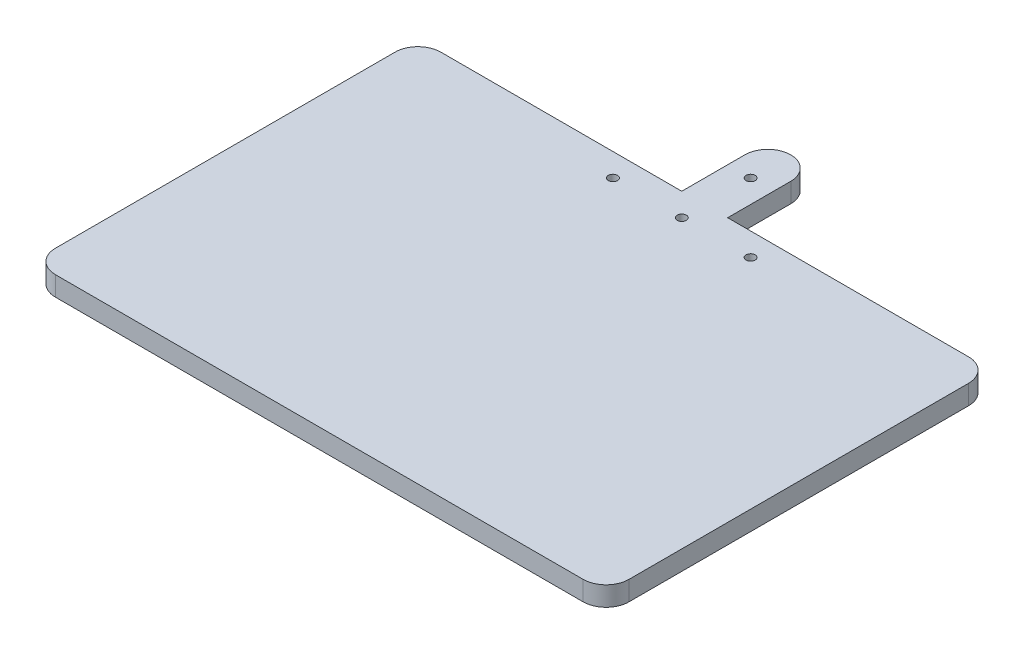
SolidWorks part; units mm, degrees
ref_plane "Front" through (0, 0, 0) normal (0, 0, 1) x (1, 0, 0)
ref_plane "Top" through (0, 0, 0) normal (0, 1, 0) x (1, 0, 0)
ref_plane "Right" through (0, 0, 0) normal (1, 0, 0) x (0, 0, -1)
sketch "Sketch1" plane through (0, 0, 0) normal (1, 0, 0) x (0, 0, -1)
  line L0 (0, 0) -> (0, -8.5)
  line L1 (0, -8.5) -> (67.49, -8.5)
  line L2 (67.49, -8.5) -> (67.49, 160.5)
  line L3 (67.49, 160.5) -> (27.987, 160.5)
  line L4 (27.987, 160.5) -> (27.987, 70)
  line L5 (27.987, 70) -> (47.49, 70)
  line L6 (47.49, 70) -> (47.49, 0)
  line L7 (47.49, 0) -> (0, 0)
  line L8 (50, 0) -> (-50, 0) construction
  line L9 (0, 50) -> (0, -50) construction
  dimension "D1" = 8.5
  dimension "D3" = 27.987
  dimension "D4" = 70
  dimension "D5" = 90.5
  dimension "D6" = 67.49
  dimension "D7" = 20
extrude "Boss-Extrude1" add sketch "Sketch1" along normal mid plane 25
hole_wizard "#55 (0.052) Diameter Hole1" positions "Sketch2" profile "Sketch3" hole size "#55" standard "ANSI Inch"
sketch "Sketch2" plane through (0, 0, -27.987) normal (0, 0, 1) x (1, 0, 0)
  line L0 (0, 77.5) -> (0, 92.5) construction
  line L1 (0, 92.5) -> (0, 107.5) construction
  line L2 (0, 107.5) -> (0, 122.5) construction
  line L4 (0, -50) -> (0, 50) construction
  line L5 (12.5, 70) -> (-12.5, 70) construction
  point P0 (0, 77.5)
  point P2 (0, 92.5)
  point P4 (0, 107.5)
  point P6 (0, 122.5)
  point P20 (0, 137.5)
  point P21 (0, 152.5)
  dimension "D1" = 15
  dimension "D2" = 7.5
  dimension "D3" = 15
  dimension "D4" = 15
sketch "Sketch3" plane through (0, 77.5, -27.987) normal (1, 0, 0) x (0, -1, 0)
  line L0 (0, 0) -> (0, 10.3968)
  line L1 (0, 10.3968) -> (0.6604, 10)
  line L2 (0.6604, 10) -> (0.6604, 0)
  line L5 (0.6604, 0) -> (0, 0)
  line L10 (0, 10.3968) -> (-0.6604, 10) construction
  line L11 (0, -6.35) -> (0, 107.95) construction
  dimension "Hole Dia." = 1.3208
  dimension "Hole Depth" = 10
  dimension "Drill Angle" = 118
sketch "Sketch4" plane through (0, 0, 0) normal (0, 1, 0) x (1, 0, 0)
  line L1 (-115, 67.4905) -> (115, 67.4905)
  line L2 (-125, 57.4905) -> (-125, -90.5095)
  line L3 (-115, -100.5095) -> (115, -100.5095)
  line L4 (125, 57.4905) -> (125, -90.5095)
  line L5 (0, 0) -> (0, 131.3458) construction
  arc A0 (-125, -90.5095) -> (-115, -100.5095) centre (-115, -90.5095) ccw
  arc A1 (115, -100.5095) -> (125, -90.5095) centre (115, -90.5095) ccw
  arc A2 (115, 67.4905) -> (125, 57.4905) centre (115, 57.4905) cw
  arc A3 (-115, 67.4905) -> (-125, 57.4905) centre (-115, 57.4905) ccw
  point P0 (0, 67.4905)
  point P11 (125, -100.5095)
  point P14 (125, 67.4905)
  point P17 (-125, 67.4905)
  dimension "D1" = 250
  dimension "D4" = 10
  dimension "D2" = 168
extrude "Boss-Extrude4" add sketch "Sketch4" against normal up to surface (8.5 mm away)
sketch "Sketch5" plane through (0, 70, 0) normal (0, -1, 0) x (1, 0, 0)
  line L0 (0, -50) -> (0, 50) construction
  line L1 (-12.5, -47.49) -> (12.5, -47.49)
  line L2 (-12.5, -47.49) -> (-12.5, -24.987)
  line L3 (-12.5, -24.987) -> (12.5, -24.987)
  line L4 (12.5, -47.49) -> (12.5, -24.987)
  line L5 (-12.5, -47.49) -> (12.5, -24.987) construction
  line L6 (-12.5, -24.987) -> (12.5, -47.49) construction
  line L7 (12.5, -27.987) -> (12.5, -47.49) construction
  line L8 (12.5, -47.49) -> (-12.5, -47.49) construction
  line L9 (12.5, -27.987) -> (-12.5, -27.987) construction
  point P0 (0, -36.2385)
  dimension "D1" = 3
extrude "Boss-Extrude5" add sketch "Sketch5" along normal blind 2
sketch "Sketch6" plane through (0, 160.5, 0) normal (0, 1, 0) x (1, 0, 0)
  line L0 (12.5, 67.49) -> (-12.5, 67.49) construction
  line L4 (12.5, 47.49) -> (-12.5, 47.49)
  line L5 (12.5, 24.987) -> (12.5, 47.49)
  line L6 (-12.5, 24.987) -> (12.5, 24.987)
  line L7 (-12.5, 47.49) -> (-12.5, 24.987)
  line L8 (12.5, 67.49) -> (-12.5, 67.49)
  line L9 (12.5, 24.987) -> (12.5, 67.49)
  line L10 (-12.5, 24.987) -> (12.5, 24.987)
  line L11 (-12.5, 67.49) -> (-12.5, 24.987)
  dimension "D1" = 0
extrude "Boss-Extrude6" add sketch "Sketch6" along normal blind 2
fillet "Fillet1" radius 5 1 edges at (0, 68, -47.49)
sketch "Sketch7" plane through (12.5, 0, 0) normal (1, 0, 0) x (0, 0, -1)
  line L0 (67.49, 0) -> (67.49, 162.5) construction
  line L1 (27.987, 160.5) -> (67.49, 160.5)
  line L2 (27.987, 160.5) -> (27.987, 150.5)
  line L3 (27.987, 150.5) -> (67.49, 150.5)
  line L4 (67.49, 160.5) -> (67.49, 150.5)
  line L5 (27.987, 160.5) -> (27.987, 70) construction
  line L6 (24.987, 162.5) -> (67.49, 162.5) construction
  dimension "D1" = 2
  dimension "D2" = 10
extrude "Boss-Extrude7" add sketch "Sketch7" along normal blind 3
sketch "Sketch8" plane through (0, 0, -27.987) normal (0, 0, 1) x (1, 0, 0)
  line L0 (15.5, 158) -> (14, 158)
  line L1 (14, 158) -> (14, 159)
  line L5 (14, 152) -> (14, 153)
  line L6 (14, 153) -> (15.5, 153)
  line L7 (15.5, 153) -> (15.5, 158)
  line L8 (12.5, 155.5) -> (15.5, 155.5) construction
  line L9 (15.5, 160.5) -> (15.5, 150.5) construction
  line L12 (14, 158) -> (14, 153) construction
  line L13 (14, 159) -> (10, 159)
  line L14 (10, 159) -> (10, 152)
  line L15 (10, 152) -> (14, 152)
  point P14 (15.5, 155.5)
  dimension "D1" = 1.5
  dimension "D2" = 4
  dimension "D3" = 5
sketch "Sketch9" plane through (0, 0, -67.49) normal (0, 0, -1) x (-1, 0, 0)
  line L0 (12.5, 0) -> (12.5, 162.5) construction
  line L1 (-12.5, 162.5) -> (12.5, 162.5)
  line L2 (-12.5, 162.5) -> (-12.5, 160.5)
  line L3 (-12.5, 160.5) -> (12.5, 160.5)
  line L4 (12.5, 162.5) -> (12.5, 160.5)
  line L5 (-15.5, 160.5) -> (-12.5, 160.5) construction
extrude "Boss-Extrude8" add sketch "Sketch9" along normal blind 3
sketch "Sketch10" plane through (0, 0, -67.49) normal (0, 0, -1) x (-1, 0, 0)
  line L0 (-12.5, 0) -> (-12.5, 150.5) construction
  line L1 (-12.5, 70) -> (12.5, 70)
  line L2 (-12.5, 70) -> (-12.5, 68)
  line L3 (-12.5, 68) -> (12.5, 68)
  line L4 (12.5, 70) -> (12.5, 68)
  line L5 (12.5, 0) -> (12.5, 160.5) construction
  line L7 (-12.5, 160.5) -> (12.5, 160.5) construction
  dimension "D1" = 2
  dimension "D2" = 90.5
extrude "Boss-Extrude9" add sketch "Sketch10" along normal blind 3
sketch "Sketch11" plane through (0, 0, -67.49) normal (0, 0, -1) x (-1, 0, 0)
  line L0 (12.5, 70) -> (-12.5, 70) construction
  point P0 (0, 77.5)
  point P1 (0, 92.5)
  point P2 (0, 107.5)
  point P3 (0, 122.5)
  point P4 (0, 137.5)
  point P5 (0, 152.5)
  dimension "D1" = 7.5
  dimension "D2" = 15
  dimension "D3" = 15
  dimension "D4" = 15
  dimension "D5" = 15
  dimension "D6" = 15
hole_wizard "#55 (0.052) Diameter Hole2" positions "Sketch12" profile "Sketch13" hole size "#55" standard "ANSI Inch"
sketch "Sketch12" plane through (0, 0, -67.49) normal (0, 0, -1) x (-1, 0, 0)
  point P0 (0, 77.5)
  point P3 (0, 92.5)
  point P6 (0, 107.5)
  point P9 (0, 122.5)
  point P12 (0, 137.5)
  point P15 (0, 152.5)
sketch "Sketch13" plane through (0, 77.5, -67.49) normal (1, 0, 0) x (0, 1, 0)
  line L0 (0, 0) -> (0, 10.3968)
  line L1 (0, 10.3968) -> (0.6604, 10)
  line L2 (0.6604, 10) -> (0.6604, 0)
  line L5 (0.6604, 0) -> (0, 0)
  line L10 (0, 10.3968) -> (-0.6604, 10) construction
  line L11 (0, -6.35) -> (0, 107.95) construction
  dimension "Hole Dia." = 1.3208
  dimension "Hole Depth" = 10
  dimension "Drill Angle" = 118
sketch "Sketch19" plane through (0, 0, -67.49) normal (0, 0, -1) x (-1, 0, 0)
  line L0 (-12.5, 68) -> (-52.9003, 0)
  line L1 (-52.9003, 0) -> (-12.5, 0)
  line L2 (-12.5, 0) -> (12.5, 0) construction
  line L3 (-12.5, 0) -> (-12.5, 68)
  line L4 (0, 68) -> (0, 0) construction
  line L5 (52.9003, 0) -> (12.5, 0)
  line L6 (12.5, 68) -> (52.9003, 0)
  line L7 (12.5, 0) -> (12.5, 68)
extrude "Extrude-Thin1" add sketch "Sketch19" against normal blind 20 thin
sketch "Sketch20" plane through (0, 0, -67.49) normal (0, 0, -1) x (-1, 0, 0)
  line L0 (-12.5, 68) -> (12.5, 68) construction
  line L1 (-10, 68) -> (10, 68)
  line L2 (-10, 68) -> (-10, 0)
  line L4 (10, 68) -> (10, 0)
  line L6 (-10, 0) -> (10, 0)
  line L7 (-52.9003, 0) -> (52.9003, 0) construction
  dimension "D1" = 20
  dimension "D2" = 2.5
extrude "Boss-Extrude11" add sketch "Sketch20" along normal blind 43
sketch "Sketch22" plane through (10, 0, 0) normal (1, 0, 0) x (0, 0, -1)
  line L1 (67.49, 68) -> (104.9772, 0)
  line L4 (104.9772, 68) -> (67.49, 68)
  line L6 (110.49, 0) -> (67.4905, 0) construction
  line L7 (104.9772, 68) -> (110.49, 68)
  line L8 (110.49, 68) -> (110.49, 0) construction
  line L9 (110.49, 68) -> (70.49, 68) construction
  line L10 (110.49, 68) -> (110.49, 0)
  line L11 (110.49, 0) -> (104.9772, 0)
extrude "Cut-Extrude4" cut sketch "Sketch22" against normal blind 43
sketch "Sketch24" plane through (10, 0, 0) normal (1, 0, 0) x (0, 0, -1)
  line L0 (72.49, 47.9007) -> (72.49, 0)
  line L2 (98.8968, 0) -> (72.49, 47.9007)
  line L3 (67.49, 68) -> (104.9772, 0) construction
  line L4 (67.49, 68) -> (67.49, 0) construction
  line L6 (72.49, 0) -> (98.8968, 0)
  line L7 (104.9772, 0) -> (67.4905, 0) construction
  dimension "D1" = 0
  dimension "D2" = 5
extrude "Cut-Extrude5" cut sketch "Sketch24" against normal blind 43
sketch "Sketch12" plane through (0, 0, -67.4905) normal (0, 0, -1) x (-1, 0, 0)
  line L0 (115, -8.5) -> (-115, -8.5) construction
  line L1 (-10, 0) -> (10, 0)
  line L2 (-10, 0) -> (-10, -8.5)
  line L3 (-10, -8.5) -> (10, -8.5)
  line L4 (10, 0) -> (10, -8.5)
  line L5 (10, 0) -> (10, 68) construction
extrude "Boss-Extrude13" add sketch "Sketch12" along normal blind 37.5
sketch "Sketch13" plane through (0, 0, -72.49) normal (0, 0, -1) x (-1, 0, 0)
  line L0 (10, 47.9007) -> (10, 0) construction
  line L1 (-10, 0) -> (10, 0)
  line L2 (-10, 0) -> (-10, 5)
  line L3 (-10, 5) -> (10, 5)
  line L4 (10, 0) -> (10, 5)
  line L5 (-44.1138, 5) -> (-17.5, 5) construction
extrude "Boss-Extrude14" add sketch "Sketch13" along normal up to next
fillet "Fillet4" radius 10 2 edges at (10, -4.25, -104.9905) (-10, -4.25, -104.9905)
sketch "Sketch28" plane through (0, 162.5, 0) normal (0, 1, 0) x (1, 0, 0)
  line L0 (12.5, 24.987) -> (12.5, 70.49) construction
  line L2 (12.5, 27.987) -> (12.5, 67.49)
  line L4 (-12.5, 27.987) -> (-12.5, 67.49)
  line L5 (15.5, 27.987) -> (12.5, 27.987) construction
  line L6 (-52.9003, 67.49) -> (-12.5, 67.49) construction
  line L7 (-12.5, 70.49) -> (-12.5, 24.987) construction
  line L8 (-12.5, 24.987) -> (12.5, 24.987)
  line L9 (12.5, 24.987) -> (12.5, 27.987)
  line L10 (-12.5, 24.987) -> (-12.5, 27.987)
  line L11 (-12.5, 67.49) -> (-12.5, 70.49)
  line L12 (-12.5, 70.49) -> (12.5, 70.49)
  line L13 (12.5, 70.49) -> (12.5, 67.49)
extrude "Boss-Extrude15" add sketch "Sketch28" along normal blind 30
sketch "Sketch36" plane through (12.5, 0, 0) normal (1, 0, 0) x (0, 0, -1)
  line L0 (24.987, 192.5) -> (70.49, 192.5) construction
  line L1 (70.49, 192.5) -> (70.49, 160.5) construction
  circle A0 centre (65.49, 189.5) radius 15
  dimension "D1" = 30
  dimension "D2" = 3
  dimension "D3" = 5
extrude "Cut-Extrude8" cut sketch "Sketch36" against normal blind 16.65
sketch "Sketch37" plane through (-12.5, 0, 0) normal (-1, 0, 0) x (0, 0, 1)
  line L0 (-24.987, 192.5) -> (-24.987, 160.5) construction
  line L1 (-70.49, 192.5) -> (-24.987, 192.5) construction
  circle A0 centre (-29.987, 189.5) radius 15
  dimension "D1" = 30
  dimension "D2" = 5
  dimension "D3" = 3
extrude "Cut-Extrude9" cut sketch "Sketch37" against normal blind 16.65
sketch "Sketch38" plane through (4.15, 0, 0) normal (-1, 0, 0) x (0, 0, 1)
  line L1 (-44.6839, 192.5) -> (-24.987, 192.5) construction
  line L2 (-24.987, 175.3579) -> (-24.987, 192.5) construction
  point P0 (-29.987, 189.5)
  dimension "D1" = 5
  dimension "D2" = 3
hole_wizard "#8-36 Tapped Hole1" positions "Sketch39" profile "Sketch40" tap size "#8-36" standard "ANSI Inch"
sketch "Sketch39" plane through (4.15, 0, 0) normal (-1, 0, 0) x (0, 0, 1)
  point P0 (-29.987, 189.5)
sketch "Sketch40" plane through (4.15, 189.5, -29.987) normal (0, 1, 0) x (0, 0, 1)
  line L0 (0, 0) -> (0, 8.35)
  line L1 (0, 8.35) -> (1.7272, 8.35)
  line L2 (1.7272, 8.35) -> (1.7272, 0)
  line L5 (1.7272, 0) -> (0, 0)
  line L11 (0, -6.35) -> (0, 107.95) construction
  dimension "Thru Tap Drill Dia." = 3.4544
  dimension "Thru Tap Drill Depth" = 8.35
sketch "Sketch41" plane through (-4.15, 0, 0) normal (1, 0, 0) x (0, 0, -1)
  line L0 (50.7931, 192.5) -> (70.49, 192.5) construction
  line L2 (70.49, 192.5) -> (70.49, 175.3579) construction
  point P0 (65.49, 189.5)
  dimension "D1" = 3
  dimension "D2" = 5
hole_wizard "#8-32 Tapped Hole1" positions "Sketch44" profile "Sketch43" tap size "#8-32" standard "ANSI Inch"
sketch "Sketch44" plane through (-4.15, 0, 0) normal (1, 0, 0) x (0, 0, -1)
  point P0 (65.49, 189.5)
sketch "Sketch43" plane through (-4.15, 189.5, -65.49) normal (0, 1, 0) x (0, 0, -1)
  line L0 (0, 0) -> (0, 8.35)
  line L1 (0, 8.35) -> (1.7272, 8.35)
  line L2 (1.7272, 8.35) -> (1.7272, 0)
  line L5 (1.7272, 0) -> (0, 0)
  line L11 (0, -6.35) -> (0, 107.95) construction
  dimension "Thru Tap Drill Dia." = 3.4544
  dimension "Thru Tap Drill Depth" = 8.35
fillet "Fillet6" radius 3 2 edges at (-8.325, 192.5, -70.49) (8.325, 192.5, -24.987)
extrude "Cut-Extrude10" cut sketch "Sketch8" against normal blind 32
sketch "Sketch45" plane through (0, 160.5, 0) normal (0, 1, 0) x (1, 0, 0)
  line L0 (15.5, 67.49) -> (15.5, 27.987) construction
  line L1 (12.5, 27.987) -> (15.5, 27.987)
  line L2 (12.5, 27.987) -> (12.5, 29.987)
  line L3 (12.5, 29.987) -> (15.5, 29.987)
  line L4 (15.5, 27.987) -> (15.5, 29.987)
  dimension "D1" = 2
extrude "Cut-Extrude11" cut sketch "Sketch45" against normal up to surface (10 mm away)
sketch "Sketch46" plane through (-4.15, 0, 0) normal (1, 0, 0) x (0, 0, -1)
  circle A0 centre (65.49, 189.5) radius 3
  circle A1 centre (65.49, 189.5) radius 1.7272
  dimension "D1" = 6
fillet "Fillet10" radius 2 4 edges at (-4.175, 192.5, -44.6839) (-4.175, 175.3579, -24.987) (4.175, 192.5, -50.7931) (4.175, 175.3579, -70.49)
sketch "Sketch47" plane through (4.15, 0, 0) normal (-1, 0, 0) x (0, 0, 1)
  circle A0 centre (-29.987, 189.5) radius 3
  circle A1 centre (-29.987, 189.5) radius 1.7272
  dimension "D1" = 6
extrude "Boss-Extrude18" add sketch "Sketch47" along normal blind 1
sketch "Sketch48" plane through (-4.15, 0, 0) normal (1, 0, 0) x (0, 0, -1)
  circle A0 centre (65.49, 189.5) radius 1.7272
  circle A1 centre (65.49, 189.5) radius 2.38
  dimension "D1" = 4.76
extrude "Boss-Extrude19" add sketch "Sketch48" along normal blind 1
extrude "Boss-Extrude17" add sketch "Sketch46" along normal blind 1
sketch "Sketch49" plane through (12.5, 0, 0) normal (1, 0, 0) x (0, 0, -1)
  line L0 (29.987, 150.5) -> (67.49, 150.5) construction
  line L1 (31.987, 146.5) -> (63.49, 146.5)
  line L2 (31.987, 146.5) -> (31.987, 72)
  line L3 (31.987, 72) -> (63.49, 72)
  line L4 (63.49, 146.5) -> (63.49, 72)
  line L5 (47.49, 68) -> (67.49, 68) construction
  line L6 (67.49, 70) -> (67.49, 150.5) construction
  line L7 (27.987, 152) -> (27.987, 70) construction
  dimension "D1" = 4
  dimension "D2" = 4
  dimension "D3" = 4
  dimension "D4" = 4
extrude "Cut-Extrude12" cut sketch "Sketch49" against normal blind 5
mirror "Mirror1" about plane through (0, 0, 0) normal (1, 0, 0) of "Cut-Extrude12"
fillet "Fillet11" radius 3 8 edges at (-10, 146.5, -31.987) (-10, 146.5, -63.49) (-10, 72, -31.987) (-10, 72, -63.49) (10, 72, -31.987) (10, 72, -63.49) (10, 146.5, -63.49) (10, 146.5, -31.987)
sketch "Sketch50" plane through (0, 0, 0) normal (0, 1, 0) x (1, 0, 0)
  line L0 (52.9003, 47.49) -> (52.9003, 67.49) construction
  line L1 (-52.9003, -6.3463) -> (52.9003, -6.3463)
  line L2 (-52.9003, -6.3463) -> (-52.9003, 113.3166)
  line L3 (-52.9003, 113.3166) -> (52.9003, 113.3166)
  line L4 (52.9003, -6.3463) -> (52.9003, 113.3166)
  line L5 (-52.9003, 47.49) -> (-52.9003, 67.49) construction
extrude "Cut-Extrude13" cut sketch "Sketch50" along normal through all
sketch "Sketch51" plane through (0, -8.5, 0) normal (0, -1, 0) x (1, 0, 0)
  line L0 (-115, -67.4905) -> (-10, -67.4905) construction
  line L1 (10, -67.4905) -> (115, -67.4905) construction
  point P0 (0, -57.4905)
  point P1 (-30, -57.4905)
  point P2 (30, -57.4905)
  point P3 (0, -87.4905)
  dimension "D1" = 10
  dimension "D2" = 10
  dimension "D3" = 10
  dimension "D4" = 30
  dimension "D5" = 30
  dimension "D6" = 30
hole_wizard "Ø4.0mm Dowel Hole1" positions "Sketch52" profile "Sketch54" hole size "Ø4.0" standard "ANSI Metric"
sketch "Sketch52" plane through (0, -8.5, 0) normal (0, -1, 0) x (-1, 0, 0)
  point P0 (30, 57.4905)
  point P3 (0, 57.4905)
  point P6 (-30, 57.4905)
  point P9 (0, 87.4905)
sketch "Sketch54" plane through (-30, -8.5, -57.4905) normal (1, 0, 0) x (0, 0, -1)
  line L0 (0, 0) -> (0, 8.5)
  line L1 (0, 8.5) -> (2, 8.5)
  line L2 (2, 8.5) -> (2, 0)
  line L5 (2, 0) -> (0, 0)
  line L11 (0, -6.35) -> (0, 107.95) construction
  dimension "Thru Hole Dia." = 4
  dimension "Thru Hole Depth" = 8.5
sketch "Sketch55" plane through (0, -8.5, 0) normal (0, -1, 0) x (1, 0, 0)
  circle A0 centre (0, -57.4905) radius 4
  circle A1 centre (-30, -57.4905) radius 4
  circle A2 centre (30, -57.4905) radius 4
  circle A3 centre (0, -87.4905) radius 4
  dimension "D1" = 8
extrude "Cut-Extrude14" cut sketch "Sketch55" against normal blind 2.5
sketch "Sketch56" plane through (0, -8.5, 0) normal (0, -1, 0) x (1, 0, 0)
  point P0 (-117.6523, 93.0217)
  point P1 (118.7648, 93.0217)
  point P2 (118.7648, -59.9541)
  point P3 (-117.6523, -59.9541)
  point P4 (-117.6523, 19.8715)
  point P5 (118.7648, 19.8715)
  point P6 (43.3895, 93.0217)
  point P7 (-37.8267, 93.0217)
  point P8 (0, -99.1715)
  point P9 (0, -66.6294)
